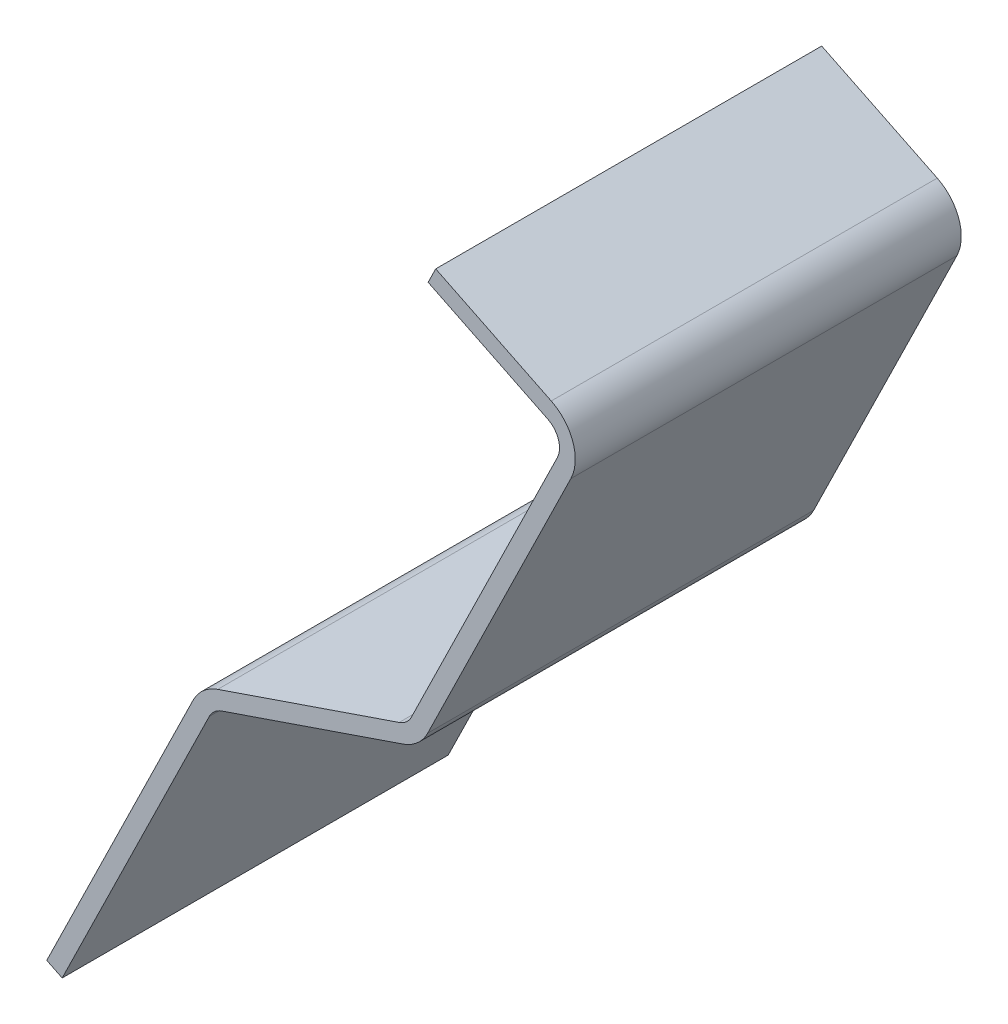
SolidWorks part; units mm, degrees
ref_plane "Plan1" through (0, 0, 0) normal (0, 0, 1) x (1, 0, 0)
ref_plane "Plan2" through (0, 0, 0) normal (0, 1, 0) x (1, 0, 0)
ref_plane "Plan3" through (0, 0, 0) normal (1, 0, 0) x (0, 0, -1)
sketch "Esquisse2" plane through (0, 0, 0) normal (0, 0, 1) x (1, 0, 0)
  line L0 (89.2949, 19.4349) -> (85.7733, 12.2517)
  line L1 (94.1121, 21.0826) -> (98.0739, 29.1637)
  line L2 (94.1121, 21.0826) -> (89.2949, 19.4349)
  line L3 (98.0739, 29.1637) -> (95.3802, 30.4843)
  line L20 (95.3802, 30.4843) -> (94.4823, 30.9245)
  dimension "D1" = 4
  dimension "D2" = 9
  dimension "D3" = 135
  dimension "D4" = 8
  dimension "D5" = 90
  dimension "D6" = 3.6
extrude "Base-Extru.-Mince" add sketch "Esquisse2" along normal blind 9 thin
fillet "Congé1" radius 0.5
fillet "Congé2" radius 1
